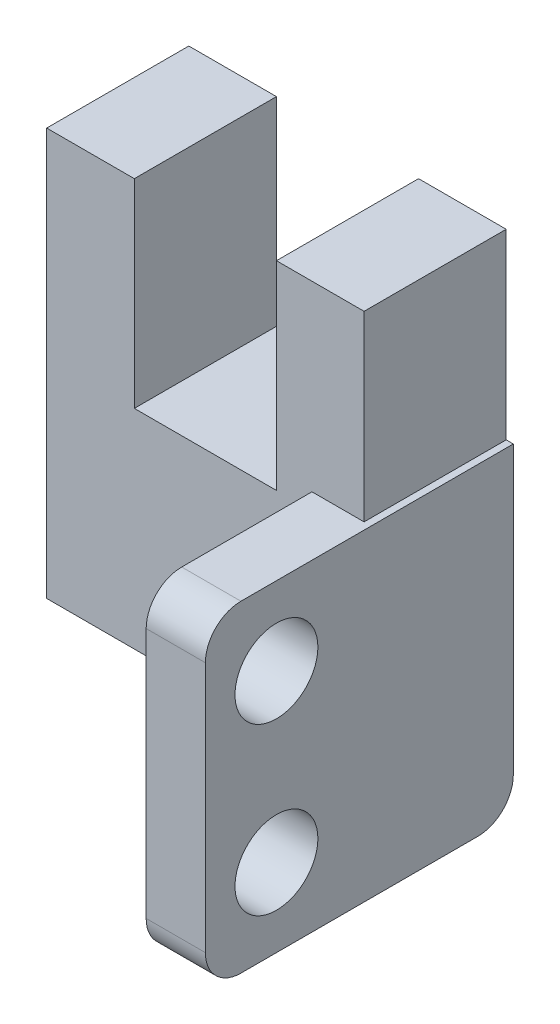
SolidWorks part; units mm, degrees
ref_plane "前视基准面" through (0, 0, 0) normal (0, 0, 1) x (1, 0, 0)
ref_plane "上视基准面" through (0, 0, 0) normal (0, 1, 0) x (1, 0, 0)
ref_plane "右视基准面" through (0, 0, 0) normal (1, 0, 0) x (0, 0, -1)
sketch "草图1" plane through (0, 0, 0) normal (0, 0, 1) x (1, 0, 0)
  line L0 (0, 0) -> (0, 17.2)
  line L1 (0, 17.2) -> (3.7, 17.2)
  line L2 (3.7, 17.2) -> (3.7, 8.8)
  line L3 (3.7, 8.8) -> (9.7, 8.8)
  line L4 (9.7, 8.8) -> (9.7, 17.2)
  line L5 (9.7, 17.2) -> (13.4, 17.2)
  line L6 (13.4, 17.2) -> (13.4, 0)
  line L7 (13.4, 0) -> (0, 0)
extrude "凸台-拉伸1" add sketch "草图1" along normal blind 6
sketch "草图2" plane through (13.4, 0, 0) normal (1, 0, 0) x (0, 0, -1)
  line L0 (0, 0) -> (0, -4.1)
  line L1 (0, -4.1) -> (-13, -4.1)
  line L2 (-13, -4.1) -> (-13, 9.5)
  line L3 (-13, 9.5) -> (0, 9.5)
  line L4 (0, 0) -> (0, 17.2) construction
  line L5 (0, 9.5) -> (0, 0)
extrude "凸台-拉伸2" add sketch "草图2" against normal blind 2.5
sketch "草图3" plane through (13.4, 0, 0) normal (1, 0, 0) x (0, 0, -1)
  line L0 (-13, -4.1) -> (0, -4.1)
  line L1 (0, -4.1) -> (0, 9.5)
  line L2 (0, -4.1) -> (0, 17.2) construction
  line L3 (0, 9.5) -> (-13, 9.5)
  line L4 (-13, 9.5) -> (-13, -4.1)
extrude "凸台-拉伸3" add sketch "草图3" along normal blind 0.3
sketch "草图4" plane through (13.7, 0, 0) normal (1, 0, 0) x (0, 0, -1)
  circle A0 centre (-10, 6.2) radius 1.75
  circle A1 centre (-10, -0.8) radius 1.75
extrude "切除-拉伸1" cut sketch "草图4" against normal blind 2.8
sketch "草图5" plane through (10.9, 0, 0) normal (-1, 0, 0) x (0, 0, 1)
  line L0 (0, -4.1) -> (13, -4.1)
  line L1 (13, -4.1) -> (13, 9.5)
  line L2 (13, 9.5) -> (6, 9.5)
  line L3 (6, 9.5) -> (6, 0)
  line L4 (6, 0) -> (0, 0)
  line L5 (0, 0) -> (0, -4.1)
extrude "切除-拉伸2" cut sketch "草图5" against normal blind 0.3
sketch "草图6" plane through (0, 0, 0) normal (0, -1, 0) x (-1, 0, 0)
  circle A0 centre (-5.6, -3) radius 1.25
extrude "凸台-拉伸4" add sketch "草图6" along normal blind 10
fillet "圆角2" radius 1.5 3 edges at (12.45, -4.1, 0) (12.45, -4.1, 13) (12.45, 9.5, 13)
